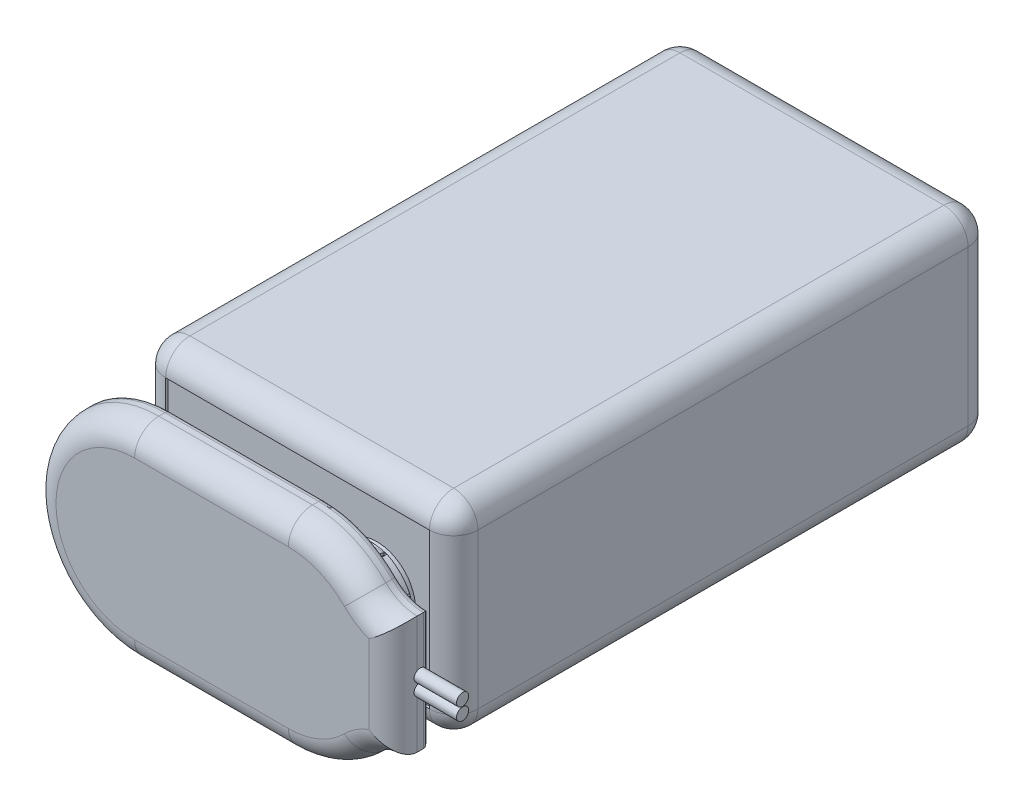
SolidWorks part; units mm, degrees
ref_plane "Front Plane" through (0, 0, 0) normal (0, 0, 1) x (1, 0, 0)
ref_plane "Top Plane" through (0, 0, 0) normal (0, 1, 0) x (1, 0, 0)
ref_plane "Right Plane" through (0, 0, 0) normal (1, 0, 0) x (0, 0, -1)
imported_body "9V-1-solid1"
imported_body "PP3BatteryClip-1-solid1"
scale "Scale1" bodies to scale 101 102 scale about centroid uniform scaling yes scale factor 0.95
